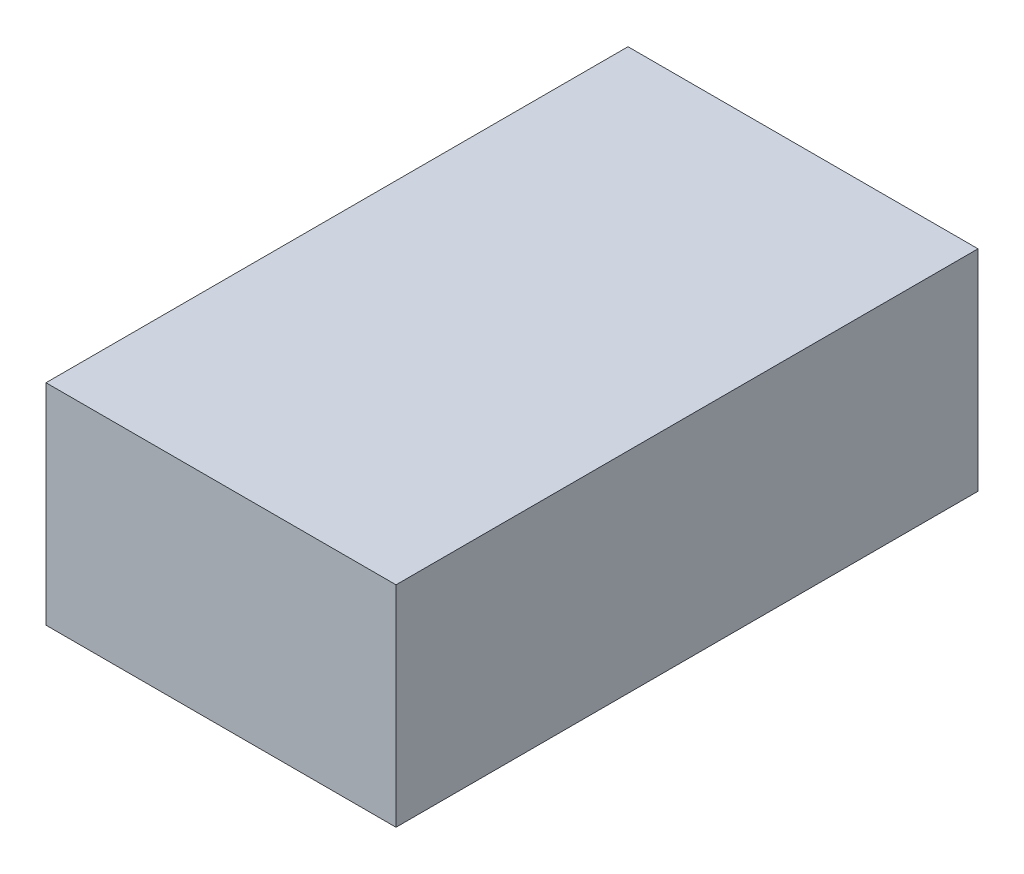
SolidWorks part; units mm, degrees
ref_plane "Front Plane" through (0, 0, 0) normal (1, 0, 0) x (0, 1, 0)
ref_plane "Top Plane" through (0, 0, 0) normal (0, 0, 1) x (0, 1, 0)
ref_plane "Right Plane" through (0, 0, 0) normal (0, 1, 0) x (-1, 0, 0)
sketch "Sketch1" plane through (0, 0, 0) normal (1, 0, 0) x (0, 1, 0)
  line L0 (-19.05, 0) -> (19.05, 0)
  line L1 (19.05, 0) -> (19.05, 105.5878)
  line L2 (19.05, 105.5878) -> (-19.05, 105.5878)
  line L3 (-19.05, 105.5878) -> (-19.05, 0)
extrude "Panel_or_block" add sketch "Sketch1" along normal blind 63.5
